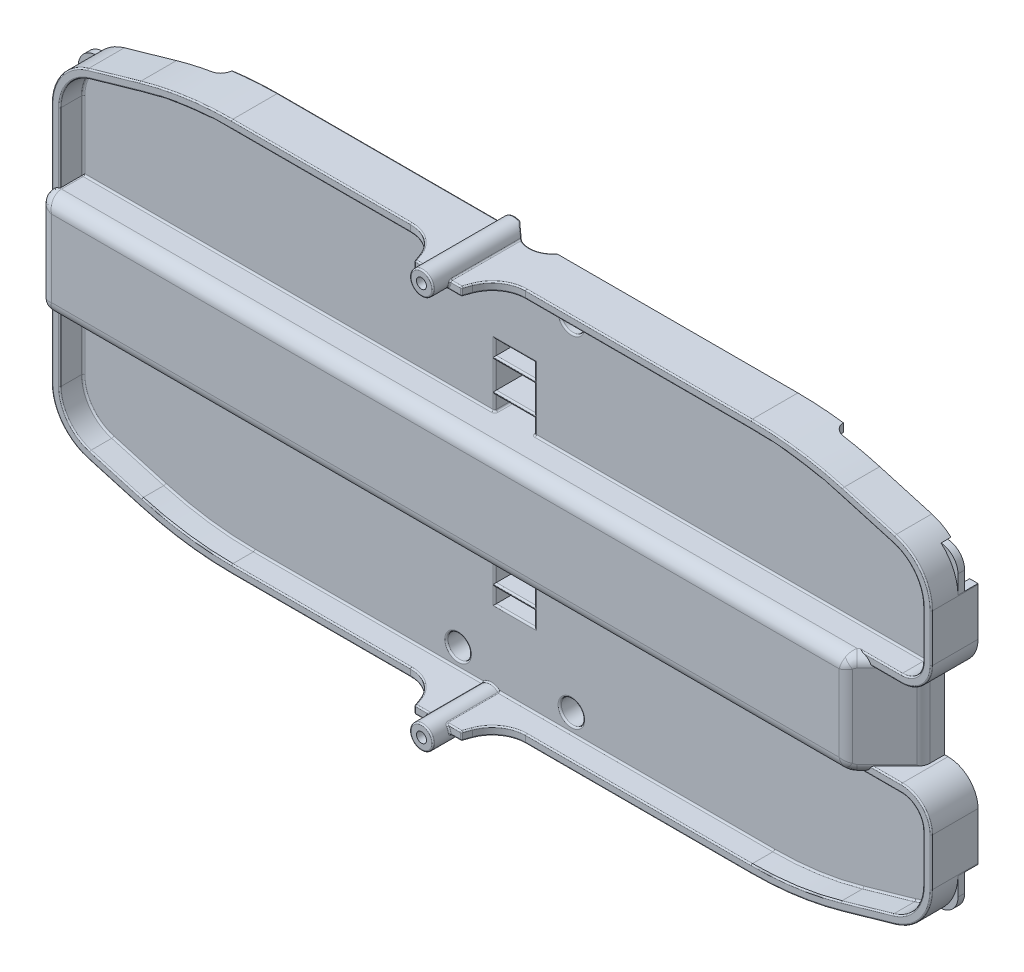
SolidWorks part; units mm, degrees
ref_plane "Face" through (0, 0, 0) normal (0, 0, 1) x (1, 0, 0)
ref_plane "Dessus" through (0, 0, 0) normal (0, 1, 0) x (1, 0, 0)
ref_plane "Droite" through (0, 0, 0) normal (1, 0, 0) x (0, 0, -1)
sketch "Esquisse1" plane through (0, 0, 0) normal (0, 0, 1) x (1, 0, 0)
  line L0 (-152.067, 0) -> (168.0741, 0) construction
  line L1 (0, 92.3334) -> (0, -84.9155) construction
  line L2 (-77.9459, 59) -> (77.9459, 59)
  line L3 (132, 36.2269) -> (132, 22)
  line L4 (105.5097, 55.1262) -> (121.1346, 50.6458)
  line L6 (-132, 13) -> (123, 13)
  line L12 (-105.5097, 55.1262) -> (-121.1346, 50.6458)
  line L13 (-132, 36.2269) -> (-132, 13)
  arc A0 (132, 36.2269) -> (121.1346, 50.6458) centre (117, 36.2269) ccw
  arc A1 (123, 13) -> (132, 22) centre (123, 22) ccw
  arc A7 (-132, 36.2269) -> (-121.1346, 50.6458) centre (-117, 36.2269) cw
  arc A8 (77.9459, 59) -> (105.5097, 55.1262) centre (77.9459, -41) cw
  arc A9 (-105.5097, 55.1262) -> (-77.9459, 59) centre (-77.9459, -41) cw
  point P37 (0, 59)
  point P38 (92, 59)
  point P41 (-92, 59)
  dimension "D3" = 15
  dimension "D6" = 9
  dimension "D7" = 26
  dimension "D10" = 100
  dimension "D2" = 59
  dimension "D4" = 16
  dimension "D5" = 40
  dimension "D8" = 264
extrude "Extrusion3" add sketch "Esquisse1" along normal mid plane 14
sketch "Esquisse6" plane through (0, 0, 7) normal (0, 0, 1) x (1, 0, 0)
  line L12 (77.9459, 56.5) -> (-77.9459, 56.5)
  line L13 (-104.8206, 52.723) -> (-120.4455, 48.2426)
  line L14 (-129.5, 36.2269) -> (-129.5, 15.5)
  line L15 (-129.5, 15.5) -> (123, 15.5)
  line L16 (129.5, 22) -> (129.5, 36.2269)
  line L17 (120.4455, 48.2426) -> (104.8206, 52.723)
  line L18 (77.9459, 56.5) -> (-77.9459, 56.5)
  line L19 (-104.8206, 52.723) -> (-120.4455, 48.2426)
  line L20 (-129.5, 36.2269) -> (-129.5, 15.5)
  line L21 (-129.5, 15.5) -> (123, 15.5)
  line L22 (129.5, 22) -> (129.5, 36.2269)
  line L23 (120.4455, 48.2426) -> (104.8206, 52.723)
  arc A10 (104.8206, 52.723) -> (77.9459, 56.5) centre (77.9459, -41) ccw
  arc A11 (-77.9459, 56.5) -> (-104.8206, 52.723) centre (-77.9459, -41) ccw
  arc A12 (-120.4455, 48.2426) -> (-129.5, 36.2269) centre (-117, 36.2269) ccw
  arc A13 (123, 15.5) -> (129.5, 22) centre (123, 22) ccw
  arc A14 (129.5, 36.2269) -> (120.4455, 48.2426) centre (117, 36.2269) ccw
  arc A15 (104.8206, 52.723) -> (77.9459, 56.5) centre (77.9459, -41) ccw
  arc A16 (-77.9459, 56.5) -> (-104.8206, 52.723) centre (-77.9459, -41) ccw
  arc A17 (-120.4455, 48.2426) -> (-129.5, 36.2269) centre (-117, 36.2269) ccw
  arc A18 (123, 15.5) -> (129.5, 22) centre (123, 22) ccw
  arc A19 (129.5, 36.2269) -> (120.4455, 48.2426) centre (117, 36.2269) ccw
  dimension "D1" = 2.5
extrude "Enlèv. mat.-Extru.2" cut sketch "Esquisse6" against normal blind 7
sketch "Esquisse8" plane through (0, 15.5, 0) normal (0, 1, 0) x (-1, 0, 0)
  line L0 (-122, -7) -> (-122, -1)
  line L1 (-105.5097, -7) -> (-77.9459, -7) construction
  line L2 (-122, -1) -> (-110, 11)
  line L3 (-110, 11) -> (132, 11)
  line L4 (132, -7) -> (132, 11)
  line L5 (-132, 7) -> (-132, -7) construction
  line L6 (77.9459, -7) -> (105.5097, -7) construction
  line L7 (-119, -7) -> (-119, -2.2426)
  line L8 (-119, -2.2426) -> (-108.7574, 8)
  line L9 (-108.7574, 8) -> (129, 8)
  line L10 (129, -7) -> (129, 8)
  line L11 (-122, -7) -> (-119, -7)
  line L12 (129, -7) -> (132, -7)
  dimension "D1" = 10
  dimension "D2" = 18
  dimension "D3" = 45
  dimension "D4" = 12
  dimension "D5" = 3
extrude "Extrusion5" add sketch "Esquisse8" against normal blind 17
mirror "Symétrie3" about plane through (0, 0, 0) normal (0, 1, 0)
mirror "Symétrie4" about plane through (0, 0, 0) normal (0, 1, 0)
mirror "Symétrie5" about plane through (0, 0, 0) normal (0, 1, 0)
sketch "Esquisse9" plane through (0, -15.5, 0) normal (0, -1, 0) x (1, 0, 0)
  line L12 (109.7574, 7) -> (108.7574, 8) construction
  line L13 (-129, 7) -> (109.7574, 7) construction
  line L14 (-129, 8) -> (-129, 7) construction
  line L15 (108.7574, 8) -> (-129, 8) construction
  line L16 (109.7574, 7) -> (108.7574, 8)
  line L17 (-129, 7) -> (109.7574, 7)
  line L18 (-129, 8) -> (-129, 7)
  line L19 (108.7574, 8) -> (-129, 8)
extrude "Extrusion6" add sketch "Esquisse9" against normal blind 3
mirror "Symétrie6" about plane through (0, 0, 0) normal (0, 1, 0)
sketch "Esquisse10" plane through (0, 0, -7) normal (0, 0, -1) x (-1, 0, 0)
  line L0 (129.497, 36.5) -> (129.5, 36.5)
  line L1 (0, 0) -> (164.5571, 0) construction
  line L2 (129.497, -36.5) -> (129.5, -36.5)
  line L24 (129.5, -36.2269) -> (129.5, 36.2269)
  line L25 (120.4455, 48.2426) -> (104.8206, 52.723)
  line L26 (77.9459, 56.5) -> (-77.9459, 56.5)
  line L27 (-104.8206, 52.723) -> (-120.4455, 48.2426)
  line L28 (-129.5, 36.2269) -> (-129.5, 22)
  line L29 (-123, 15.5) -> (-119.5, 15.5)
  line L30 (-123, 15.5) -> (-119.5, 15.5)
  line L31 (-119.5, 15.5) -> (-119.5, -15.5)
  line L32 (-119.5, 15.5) -> (-119.5, -15.5)
  line L33 (-119.5, -15.5) -> (-123, -15.5)
  line L34 (-119.5, -15.5) -> (-123, -15.5)
  line L35 (-129.5, -22) -> (-129.5, -36.2269)
  line L36 (129.5, -36.5) -> (129.5, 36.5)
  line L37 (120.4455, 48.2426) -> (104.8206, 52.723)
  line L38 (77.9459, 56.5) -> (-77.9459, 56.5)
  line L39 (-104.8206, 52.723) -> (-120.4455, 48.2426)
  line L40 (-129.5, 36.2269) -> (-129.5, 22)
  line L41 (-129.5, -22) -> (-129.5, -36.2269)
  line L42 (-120.4455, -48.2426) -> (-104.8206, -52.723)
  line L43 (-120.4455, -48.2426) -> (-104.8206, -52.723)
  line L44 (-77.9459, -56.5) -> (77.9459, -56.5)
  line L45 (-77.9459, -56.5) -> (77.9459, -56.5)
  line L46 (104.8206, -52.723) -> (120.4455, -48.2426)
  line L47 (104.8206, -52.723) -> (120.4455, -48.2426)
  arc A0 (129.497, -36.5) -> (120.4455, -48.2426) centre (117, -36.2269) cw
  arc A20 (120.4455, -48.2426) -> (129.5, -36.2269) centre (117, -36.2269) ccw
  arc A21 (129.5, 36.2269) -> (120.4455, 48.2426) centre (117, 36.2269) ccw
  arc A22 (104.8206, 52.723) -> (77.9459, 56.5) centre (77.9459, -41) ccw
  arc A23 (-77.9459, 56.5) -> (-104.8206, 52.723) centre (-77.9459, -41) ccw
  arc A24 (-120.4455, 48.2426) -> (-129.5, 36.2269) centre (-117, 36.2269) ccw
  arc A25 (-129.5, 22) -> (-123, 15.5) centre (-123, 22) ccw
  arc A27 (-123, -15.5) -> (-129.5, -22) centre (-123, -22) ccw
  arc A28 (-123, -15.5) -> (-129.5, -22) centre (-123, -22) ccw
  arc A29 (-129.5, -36.2269) -> (-120.4455, -48.2426) centre (-117, -36.2269) ccw
  arc A30 (-129.5, -36.2269) -> (-120.4455, -48.2426) centre (-117, -36.2269) ccw
  arc A31 (129.497, 36.5) -> (120.4455, 48.2426) centre (117, 36.2269) ccw
  arc A32 (104.8206, 52.723) -> (77.9459, 56.5) centre (77.9459, -41) ccw
  arc A33 (-77.9459, 56.5) -> (-104.8206, 52.723) centre (-77.9459, -41) ccw
  arc A34 (-120.4455, 48.2426) -> (-129.5, 36.2269) centre (-117, 36.2269) ccw
  arc A35 (-129.5, 22) -> (-123, 15.5) centre (-123, 22) ccw
  arc A36 (-104.8206, -52.723) -> (-77.9459, -56.5) centre (-77.9459, 41) ccw
  arc A37 (-104.8206, -52.723) -> (-77.9459, -56.5) centre (-77.9459, 41) ccw
  arc A38 (77.9459, -56.5) -> (104.8206, -52.723) centre (77.9459, 41) ccw
  arc A39 (77.9459, -56.5) -> (104.8206, -52.723) centre (77.9459, 41) ccw
  point P10 (129.5, 0)
  dimension "D2" = 36.5
  dimension "D1" = 2.5
extrude "Enlèv. mat.-Extru.3" cut sketch "Esquisse10" against normal blind 4
fillet "Congé8" radius 2
fillet "Congé2" radius 3
fillet "Congé4" radius 4
sketch "Esquisse11" plane through (0, 0, -7) normal (0, 0, -1) x (-1, 0, 0)
  line L1 (91.6, 71.9843) -> (145.0851, 71.9843)
  line L2 (91.6, 71.9843) -> (91.6, 36.5)
  line L3 (91.6, 36.5) -> (145.0851, 36.5)
  line L4 (145.0851, 71.9843) -> (145.0851, 36.5)
  line L5 (0, 0) -> (241.3873, 0) construction
  line L6 (0, 0) -> (0, 112.0725) construction
  line L7 (-145.0851, 71.9843) -> (-145.0851, 36.5)
  line L8 (-91.6, 36.5) -> (-145.0851, 36.5)
  line L9 (-91.6, 71.9843) -> (-91.6, 36.5)
  line L10 (-91.6, 71.9843) -> (-145.0851, 71.9843)
  line L11 (-91.6, -71.9843) -> (-145.0851, -71.9843)
  line L12 (-91.6, -71.9843) -> (-91.6, -36.5)
  line L13 (-91.6, -36.5) -> (-145.0851, -36.5)
  line L14 (-145.0851, -71.9843) -> (-145.0851, -36.5)
  line L15 (145.0851, -71.9843) -> (145.0851, -36.5)
  line L16 (91.6, -36.5) -> (145.0851, -36.5)
  line L17 (91.6, -71.9843) -> (91.6, -36.5)
  line L18 (91.6, -71.9843) -> (145.0851, -71.9843)
  dimension "D2" = 36.5
extrude "Enlèv. mat.-Extru.4" cut sketch "Esquisse11" against normal blind 3
fillet "Congé6" radius 3
sketch "Esquisse12" plane through (0, 0, -3) normal (0, 0, -1) x (-1, 0, 0)
  line L0 (-119, -13) -> (129, -13) construction
  line L1 (-119, -13) -> (129, -13)
  line L2 (-119, -14) -> (129, -14)
  line L3 (-119, -13) -> (-119, -14)
  line L4 (129, -13) -> (129, -14)
  line L7 (0, 0) -> (-159.2405, 0) construction
  line L8 (129, 13) -> (129, 14)
  line L9 (-119, 13) -> (-119, 14)
  line L10 (-119, 14) -> (129, 14)
  line L11 (-119, 13) -> (129, 13)
  dimension "D1" = 1
extrude "Extrusion8" add sketch "Esquisse12" along normal blind 2
mirror "Symétrie7" about plane through (0, 0, 0) normal (0, 1, 0)
sketch "Esquisse14" plane through (0, 0, -3) normal (0, 0, -1) x (-1, 0, 0)
  line L0 (-119, -14) -> (129, -14) construction
  line L1 (-52.5, -14) -> (-51.5, -14)
  line L2 (-77.9459, -56.5) -> (77.9459, -56.5) construction
  line L3 (-52.5, -56.5) -> (-51.5, -56.5)
  line L4 (-52.5, -14) -> (-52.5, -56.5)
  line L5 (-51.5, -14) -> (-51.5, -56.5)
  line L6 (-129.5, -22) -> (-129.5, -36.2269) construction
  line L7 (0, 0) -> (189.4484, 0) construction
  line L8 (-17.5, -14) -> (-16.5, -14)
  line L9 (-17.5, -14) -> (-17.5, -56.5)
  line L10 (-17.5, -56.5) -> (-16.5, -56.5)
  line L11 (-16.5, -14) -> (-16.5, -56.5)
  line L12 (-16.5, 14) -> (-16.5, 56.5)
  line L13 (-17.5, 56.5) -> (-16.5, 56.5)
  line L14 (-17.5, 14) -> (-17.5, 56.5)
  line L15 (-17.5, 14) -> (-16.5, 14)
  line L16 (-51.5, 14) -> (-51.5, 56.5)
  line L17 (-52.5, 14) -> (-52.5, 56.5)
  line L18 (-52.5, 56.5) -> (-51.5, 56.5)
  line L19 (-52.5, 14) -> (-51.5, 14)
  line L20 (0, 0) -> (0, 94.726) construction
  line L21 (52.5, 14) -> (51.5, 14)
  line L22 (52.5, 56.5) -> (51.5, 56.5)
  line L23 (52.5, 14) -> (52.5, 56.5)
  line L24 (51.5, 14) -> (51.5, 56.5)
  line L25 (17.5, 14) -> (16.5, 14)
  line L26 (17.5, 14) -> (17.5, 56.5)
  line L27 (17.5, 56.5) -> (16.5, 56.5)
  line L28 (16.5, 14) -> (16.5, 56.5)
  line L29 (16.5, -14) -> (16.5, -56.5)
  line L30 (17.5, -56.5) -> (16.5, -56.5)
  line L31 (17.5, -14) -> (17.5, -56.5)
  line L32 (17.5, -14) -> (16.5, -14)
  line L33 (51.5, -14) -> (51.5, -56.5)
  line L34 (52.5, -14) -> (52.5, -56.5)
  line L35 (52.5, -56.5) -> (51.5, -56.5)
  line L36 (52.5, -14) -> (51.5, -14)
  line L37 (77.9459, 56.5) -> (-77.9459, 56.5) construction
  dimension "D1" = 1
  dimension "D2" = 77
  dimension "D3" = 1
  dimension "D4" = 34
extrude "Extrusion9" add sketch "Esquisse14" along normal blind 4
sketch "Esquisse15" plane through (0, 0, -3) normal (0, 0, -1) x (-1, 0, 0)
  line L0 (129.5, -36.5) -> (129.5, 36.5) construction
  line L1 (129.5, 35.5) -> (52.5, 35.5)
  line L2 (129.5, 35.5) -> (129.5, 36.5)
  line L3 (129.5, 36.5) -> (52.5, 36.5)
  line L4 (52.5, 35.5) -> (52.5, 36.5)
  line L5 (124.3571, 47.5) -> (52.5, 47.5)
  line L6 (124.3571, 47.5) -> (124.3571, 48.5)
  line L7 (124.3571, 48.5) -> (52.5, 48.5)
  line L8 (52.5, 47.5) -> (52.5, 48.5)
  line L9 (52.5, 14) -> (52.5, 56.5) construction
  line L11 (0, 0) -> (165.7762, 0) construction
  line L12 (0, 0) -> (0, 78.154) construction
  line L13 (-52.5, 47.5) -> (-52.5, 48.5)
  line L14 (-124.3571, 48.5) -> (-52.5, 48.5)
  line L15 (-124.3571, 47.5) -> (-124.3571, 48.5)
  line L16 (-124.3571, 47.5) -> (-52.5, 47.5)
  line L17 (-52.5, 35.5) -> (-52.5, 36.5)
  line L18 (-129.5, 36.5) -> (-52.5, 36.5)
  line L19 (-129.5, 35.5) -> (-129.5, 36.5)
  line L20 (-129.5, 35.5) -> (-52.5, 35.5)
  line L21 (-129.5, -35.5) -> (-52.5, -35.5)
  line L22 (-129.5, -35.5) -> (-129.5, -36.5)
  line L23 (-129.5, -36.5) -> (-52.5, -36.5)
  line L24 (-52.5, -35.5) -> (-52.5, -36.5)
  line L25 (-124.3571, -47.5) -> (-52.5, -47.5)
  line L26 (-124.3571, -47.5) -> (-124.3571, -48.5)
  line L27 (-124.3571, -48.5) -> (-52.5, -48.5)
  line L28 (-52.5, -47.5) -> (-52.5, -48.5)
  line L29 (52.5, -47.5) -> (52.5, -48.5)
  line L30 (124.3571, -48.5) -> (52.5, -48.5)
  line L31 (124.3571, -47.5) -> (124.3571, -48.5)
  line L32 (124.3571, -47.5) -> (52.5, -47.5)
  line L33 (52.5, -35.5) -> (52.5, -36.5)
  line L34 (129.5, -36.5) -> (52.5, -36.5)
  line L35 (129.5, -35.5) -> (129.5, -36.5)
  line L36 (129.5, -35.5) -> (52.5, -35.5)
  dimension "D1" = 1
  dimension "D2" = 1
  dimension "D3" = 48.5
  dimension "D4" = 13
extrude "Extrusion10" add sketch "Esquisse15" along normal blind 1
fillet "Congé10" radius 0.4
sketch "Esquisse16" plane through (0, 0, -7) normal (0, 0, -1) x (-1, 0, 0)
  line L0 (17.5, 14) -> (17.5, 56.5) construction
  line L1 (16.5, 56.5) -> (16.5, 14) construction
  line L2 (-16.5, 14) -> (-16.5, 56.5) construction
  line L3 (-17.5, 56.5) -> (-17.5, 14) construction
  line L4 (-51.5, 14) -> (-51.5, 56.5) construction
  line L5 (-52.5, 56.5) -> (-52.5, 14) construction
  line L6 (17.5, -56.1477) -> (17.5, 56.5)
  line L7 (16.5, 56.5) -> (16.5, -56.1477)
  line L8 (-16.5, -56.1477) -> (-16.5, 56.5)
  line L9 (-17.5, 56.5) -> (-17.5, -56.1477)
  line L10 (-51.5, -56.1477) -> (-51.5, 56.5)
  line L11 (-52.5, 56.5) -> (-52.5, -56.1477)
  line L12 (-52.5, 56.5) -> (-51.5, 56.5)
  line L14 (-51.5, -56.5) -> (-17.5, -56.5) construction
  line L15 (-52.5, -56.1477) -> (-51.5, -56.1477)
  line L18 (16.5, -56.1477) -> (17.5, -56.1477)
  line L19 (-17.5, -56.1477) -> (-16.5, -56.1477)
  line L20 (-17.5, 56.5) -> (-16.5, 56.5)
  line L21 (16.5, 56.5) -> (17.5, 56.5)
  line L22 (52.5, 14) -> (52.5, 56.5) construction
  line L23 (51.5, 56.5) -> (51.5, 14) construction
  line L24 (52.5, -56.5) -> (52.5, 56.5)
  line L25 (51.5, 56.5) -> (51.5, -56.5)
  line L26 (51.5, -56.5) -> (52.5, -56.5)
  line L29 (51.5, 56.5) -> (52.5, 56.5)
extrude "Extrusion11" add sketch "Esquisse16" against normal up to body separate body
sketch "Esquisse17" plane through (0, 0, -3) normal (0, 0, -1) x (-1, 0, 0)
  line L0 (0, 0) -> (0, 78.5356) construction
  line L2 (10, 13) -> (-10, 13)
  line L3 (-16.5, 13) -> (16.5, 13) construction
  line L4 (-10, 13) -> (-10, 16)
  line L5 (-10, 16) -> (-9.5, 16)
  line L6 (-7.5, 18) -> (-7.5, 35)
  line L7 (-7.5, 35) -> (7.5, 35)
  line L8 (7.5, 18) -> (7.5, 35)
  line L9 (10, 16) -> (9.5, 16)
  line L10 (10, 13) -> (10, 16)
  line L11 (0, 0) -> (63.3273, 0) construction
  line L12 (10, -13) -> (10, -16)
  line L13 (10, -16) -> (9.5, -16)
  line L14 (7.5, -18) -> (7.5, -35)
  line L15 (-7.5, -35) -> (7.5, -35)
  line L16 (-7.5, -18) -> (-7.5, -35)
  line L17 (-10, -16) -> (-9.5, -16)
  line L18 (-10, -13) -> (-10, -16)
  line L19 (10, -13) -> (-10, -13)
  arc A0 (-7.5, 18) -> (-9.5, 16) centre (-9.5, 18) cw
  arc A1 (7.5, 18) -> (9.5, 16) centre (9.5, 18) ccw
  arc A2 (7.5, -18) -> (9.5, -16) centre (9.5, -18) cw
  arc A3 (-7.5, -18) -> (-9.5, -16) centre (-9.5, -18) ccw
  point P17 (0, 35)
  point P19 (0, 13)
  point P32 (0, -13)
  point P33 (0, -35)
  dimension "D5" = 2
  dimension "D1" = 10
  dimension "D2" = 3
  dimension "D3" = 22
  dimension "D4" = 15
extrude "Extrusion12" add sketch "Esquisse17" along normal blind 10
sketch "Esquisse18" plane through (0, 0, -13) normal (0, 0, -1) x (-1, 0, 0)
  line L0 (0, 0) -> (0, 66.6064) construction
  line L1 (-10, 13) -> (10, 13) construction
  line L2 (-3.5, 35) -> (-2.5, 35)
  line L3 (-3.5, 35) -> (-3.5, 13)
  line L4 (-3.5, 13) -> (-2.5, 13)
  line L5 (-2.5, 35) -> (-2.5, 13)
  line L6 (7.5, 35) -> (-7.5, 35) construction
  line L7 (2.5, 35) -> (2.5, 13)
  line L8 (3.5, 13) -> (2.5, 13)
  line L9 (3.5, 35) -> (3.5, 13)
  line L10 (3.5, 35) -> (2.5, 35)
  line L11 (0, 0) -> (40.6148, 0) construction
  line L12 (3.5, -35) -> (2.5, -35)
  line L13 (3.5, -35) -> (3.5, -13)
  line L14 (3.5, -13) -> (2.5, -13)
  line L15 (2.5, -35) -> (2.5, -13)
  line L16 (-2.5, -35) -> (-2.5, -13)
  line L17 (-3.5, -13) -> (-2.5, -13)
  line L18 (-3.5, -35) -> (-3.5, -13)
  line L19 (-3.5, -35) -> (-2.5, -35)
  dimension "D1" = 5
  dimension "D2" = 1
extrude "Extrusion13" add sketch "Esquisse18" along normal blind 2
chamfer "Chanfrein2" distance 2 angle 45
sketch "Esquisse19" plane through (0, 0, -13) normal (0, 0, -1) x (-1, 0, 0)
  line L4 (2.5, 13) -> (2.5, 35)
  line L5 (2.5, 35) -> (-2.5, 35)
  line L6 (-2.5, 35) -> (-2.5, 13)
  line L7 (-2.5, 13) -> (2.5, 13)
  line L8 (2.5, 13) -> (2.5, 35)
  line L9 (2.5, 35) -> (-2.5, 35)
  line L10 (-2.5, 35) -> (-2.5, 13)
  line L11 (-2.5, 13) -> (2.5, 13)
  line L12 (-2.5, -13) -> (-2.5, -35)
  line L13 (-2.5, -35) -> (2.5, -35)
  line L14 (2.5, -35) -> (2.5, -13)
  line L15 (2.5, -13) -> (-2.5, -13)
  line L16 (-2.5, -13) -> (-2.5, -35)
  line L17 (-2.5, -35) -> (2.5, -35)
  line L18 (2.5, -35) -> (2.5, -13)
  line L19 (2.5, -13) -> (-2.5, -13)
  dimension "D1" = 0
  dimension "D2" = 0
extrude "Enlèv. mat.-Extru.5" cut sketch "Esquisse19" against normal blind 4
fillet "Congé11" radius 2.5
sketch "Esquisse20" plane through (0, 0, -13) normal (0, 0, -1) x (-1, 0, 0)
  line L0 (-10, 13) -> (-5.5, 13) construction
  line L1 (-7.75, 13) -> (7.052, 13)
  line L2 (-7.75, 13) -> (-7.75, 14.5)
  line L3 (-7.75, 14.5) -> (7.052, 14.5)
  line L4 (7.052, 13) -> (7.052, 14.5)
  line L5 (0, 0) -> (91.6094, 0) construction
  line L6 (7.052, -13) -> (7.052, -14.5)
  line L7 (-7.75, -14.5) -> (7.052, -14.5)
  line L8 (-7.75, -13) -> (-7.75, -14.5)
  line L9 (-7.75, -13) -> (7.052, -13)
  dimension "D1" = 1.5
extrude "Extrusion14" add sketch "Esquisse20" against normal up to body separate body
ref_plane "Plan1" through (0, 21, 0) normal (0, -1, 0) x (1, 0, 0)
sketch "Esquisse21" plane through (0, 21, 0) normal (0, -1, 0) x (1, 0, 0)
  line L0 (-16.5, -3) -> (-10, -3) construction
  line L1 (-12, -3) -> (12, -3)
  line L2 (0, 0) -> (0, -20.8343) construction
  line L3 (-12, -3) -> (-10.2314, -16.2643)
  line L4 (-8.249, -18) -> (8.249, -18)
  line L5 (12, -3) -> (10.2314, -16.2643)
  arc A0 (-8.249, -18) -> (-10.2314, -16.2643) centre (-8.249, -16) cw
  arc A1 (10.2314, -16.2643) -> (8.249, -18) centre (8.249, -16) cw
  point P10 (0, -18)
  point P11 (0, -3)
  point P13 (-10, -18)
  point P16 (10, -18)
  dimension "D4" = 2
  dimension "D1" = 12
  dimension "D2" = 10
  dimension "D3" = 15
extrude "Extrusion15" add sketch "Esquisse21" against normal blind 2
ref_plane "Plan2" through (0, 27, 0) normal (0, -1, 0) x (1, 0, 0)
sketch "Esquisse22" plane through (0, 27, 0) normal (0, -1, 0) x (1, 0, 0)
  line L0 (0, 0) -> (0, -28.0469) construction
  line L1 (-14.1283, -3) -> (-12.0714, -16.3056)
  line L2 (16.5, -3) -> (-16.5, -3) construction
  line L3 (-10.0949, -18) -> (0, -18)
  line L4 (-14.1283, -3) -> (0, -3)
  line L5 (-8.249, -18) -> (8.249, -18) construction
  line L6 (0, -18) -> (8.944, -18)
  line L7 (10.9213, -16.3003) -> (12.9413, -3)
  line L8 (12.9413, -3) -> (0, -3)
  arc A0 (-12.0714, -16.3056) -> (-10.0949, -18) centre (-10.0949, -16) ccw
  arc A1 (8.944, -18) -> (10.9213, -16.3003) centre (8.944, -16) ccw
  dimension "D1" = 2
  dimension "D2" = 2
extrude "Extrusion16" add sketch "Esquisse22" against normal blind 2
sketch "Esquisse23" plane through (0, 23, 0) normal (0, 1, 0) x (-1, 0, 0)
  circle A0 centre (0, -11.5) radius 6
  arc A1 (2.5, -11.5) -> (0, -9) centre (0, -11.5) ccw construction
  dimension "D1" = 12
extrude "Extrusion17" add sketch "Esquisse23" along normal blind 4
mirror "Symétrie10" about plane through (0, 0, 0) normal (0, 1, 0)
sketch "Esquisse25" plane through (0, 0, 0) normal (0, 0, 1) x (1, 0, 0)
  line L0 (0, 0) -> (0, 48.6052) construction
  line L1 (0, 0) -> (136.0911, 0) construction
  line L2 (-6, 29) -> (-6, 21)
  line L3 (-6, 21) -> (6, 21)
  line L4 (-6, 29) -> (6, 29)
  line L5 (12.9413, 29) -> (7.5, 29) construction
  line L6 (-6, 25) -> (11.3284, 25) construction
  line L7 (12, 21) -> (7.5, 21) construction
  line L8 (6, 29) -> (6, 21)
  line L9 (6, -29) -> (6, -21)
  line L10 (-6, -29) -> (6, -29)
  line L11 (-6, -21) -> (6, -21)
  line L12 (-6, -29) -> (-6, -21)
  line L13 (6, 20) -> (-6, 20)
  line L14 (-6, 20) -> (-6, 15.5)
  line L15 (-6, 15.5) -> (6, 15.5)
  line L16 (-129, 15.5) -> (109.7574, 15.5) construction
  line L17 (6, 20) -> (6, 15.5)
  line L18 (6, -20) -> (6, -15.5)
  line L19 (-6, -15.5) -> (6, -15.5)
  line L20 (-6, -20) -> (-6, -15.5)
  line L21 (6, -20) -> (-6, -20)
  line L22 (6, 30) -> (6, 34.5)
  line L23 (-6, 34.5) -> (6, 34.5)
  line L24 (-6, 30) -> (-6, 34.5)
  line L25 (6, 30) -> (-6, 30)
  line L26 (-6, -25) -> (11.3284, -25) construction
  line L27 (6, -30) -> (-6, -30)
  line L28 (-6, -30) -> (-6, -34.5)
  line L29 (-6, -34.5) -> (6, -34.5)
  line L30 (6, -30) -> (6, -34.5)
  point P14 (0, 29)
  point P15 (0, 21)
  point P19 (0, -21)
  point P20 (0, -29)
  point P28 (0, 15.5)
  point P29 (0, 20)
  point P33 (0, -20)
  point P34 (0, -15.5)
  point P40 (0, 30)
  point P41 (0, 34.5)
  point P48 (0, -34.5)
  point P49 (0, -30)
  dimension "D1" = 12
  dimension "D2" = 1
extrude "Enlèv. mat.-Extru.6" cut sketch "Esquisse25" against normal blind 10
sketch "Esquisse26" plane through (0, 29, 0) normal (0, 1, 0) x (-1, 0, 0)
  circle A0 centre (0, -11.5) radius 2.5
extrude "Enlèv. mat.-Extru.7" cut sketch "Esquisse26" against normal blind 10
sketch "Esquisse27" plane through (0, 20, 0) normal (0, -1, 0) x (1, 0, 0)
  line L0 (2, -10) -> (3.1623, -10)
  line L1 (-2, -10) -> (-3.1623, -10)
  line L2 (6, -10) -> (2, -10) construction
  line L3 (-2, -10) -> (-6, -10) construction
  arc A0 (2, -10) -> (-2, -10) centre (0, -11.5) ccw construction
  arc A1 (2, -10) -> (-2, -10) centre (0, -11.5) ccw
  arc A2 (3.1623, -10) -> (-3.1623, -10) centre (0, -11.5) ccw
  dimension "D1" = 1
extrude "Extrusion20" add sketch "Esquisse27" along normal blind 5
mirror "Symétrie11" about plane through (0, 0, 0) normal (0, 1, 0)
sketch "Esquisse28" plane through (0, -30, 0) normal (0, -1, 0) x (1, 0, 0)
  line L0 (-3.1623, -10) -> (-2, -10)
  line L1 (2, -10) -> (3.1623, -10)
  arc A0 (2, -10) -> (-2, -10) centre (0, -11.5) ccw
  arc A1 (3.1623, -10) -> (-3.1623, -10) centre (0, -11.5) ccw construction
  arc A2 (3.1623, -10) -> (-3.1623, -10) centre (0, -11.5) ccw
extrude "Extrusion21" add sketch "Esquisse28" along normal blind 5
mirror "Symétrie12" about plane through (0, 0, 0) normal (0, 1, 0)
fillet "Congé12" radius 0.2
fillet "Congé13" radius 0.2
sketch "Esquisse29" plane through (0, 0, -3) normal (0, 0, -1) x (-1, 0, 0)
  line L0 (0, 0) -> (0, 77.2503) construction
  line L1 (0, 0) -> (162.731, 0) construction
  circle A0 centre (-17, 51) radius 4.75
  circle A1 centre (17, 51) radius 4.75
  circle A2 centre (-17, -51) radius 4.75
  circle A3 centre (17, -51) radius 4.75
  dimension "D2" = 9.5
  dimension "D1" = 17
  dimension "D3" = 51
extrude "Extrusion22" add sketch "Esquisse29" along normal blind 5
sketch "Esquisse30" plane through (0, 0, 0) normal (0, 0, 1) x (1, 0, 0)
  line L0 (0, 0) -> (0, 76.7727) construction
  line L1 (0, 0) -> (34.8838, 0) construction
  circle A0 centre (17, 51) radius 3.5
  circle A1 centre (-17, 51) radius 3.5
  circle A2 centre (-17, -51) radius 3.5
  circle A3 centre (17, -51) radius 3.5
  dimension "D1" = 7
extrude "Enlèv. mat.-Extru.8" cut sketch "Esquisse30" against normal blind 7
fillet "Congé15" radius 0.5
sketch "Esquisse31" plane through (0, 0, -7) normal (0, 0, 1) x (1, 0, 0)
  line L0 (0, 0) -> (0, 71.1481) construction
  line L1 (0, 0) -> (38.9814, 0) construction
  circle A0 centre (17, 51) radius 1.5
  circle A1 centre (-17, 51) radius 1.5
  circle A2 centre (-17, -51) radius 1.5
  circle A3 centre (17, -51) radius 1.5
  dimension "D1" = 3
extrude "Enlèv. mat.-Extru.9" cut sketch "Esquisse31" against normal blind 7
sketch "Esquisse33" plane through (0, 59, 0) normal (0, 1, 0) x (-1, 0, 0)
  circle A0 centre (0, -11.5) radius 7
  dimension "D1" = 14
sketch "Esquisse34" plane through (0, 0, -7) normal (0, 0, -1) x (-1, 0, 0)
  circle A0 centre (7, 59) radius 3.5
  dimension "D1" = 7
  dimension "D2" = 59
  dimension "D3" = 7
extrude "Extrusion23" add sketch "Esquisse34" against normal blind 28
sketch "Esquisse35" plane through (0, 59, 0) normal (0, 1, 0) x (-1, 0, 0)
  line L0 (7, 21) -> (7, -24.3314) construction
  line L1 (10.5, 21) -> (3.5, 21) construction
  line L2 (0, 16) -> (-3.3934, 6.6)
  line L3 (3.5, 6.6) -> (-77.9459, 6.6) construction
  line L4 (14, 16) -> (17.3934, 6.6)
  line L5 (0, 16) -> (14, 16)
  line L6 (-3.3934, 6.6) -> (17.3934, 6.6)
  point P11 (7, 16)
  point P12 (7, 6.6)
  dimension "D1" = 5
extrude "Extrusion24" add sketch "Esquisse35" against normal blind 2.5
mirror "Symétrie13" about plane through (0, 0, 0) normal (0, 1, 0)
extrude "Enlèv. mat.-Extru.10" cut sketch "Esquisse33" against normal mid plane 12.5
mirror "Symétrie14" about plane through (0, 0, 0) normal (0, 1, 0)
fillet "Congé16" radius 10
fillet "Congé17" radius 0.4
fillet "Congé18" radius 0.4
fillet "Congé19" radius 0.4
sketch "Esquisse36" plane through (0, 0, 21) normal (0, 0, 1) x (1, 0, 0)
  line L0 (0, 0) -> (43.8034, 0) construction
  circle A0 centre (-7, 59) radius 1.5
  circle A1 centre (-7, -59) radius 1.5
  dimension "D1" = 3
extrude "Enlèv. mat.-Extru.11" cut sketch "Esquisse36" against normal blind 10
mirror "Symétrie15" about plane through (0, 0, 0) normal (0, 1, 0)
fillet "Congé20" radius 0.2
sketch "Esquisse40" plane through (0, 0, -7) normal (0, 0, -1) x (-1, 0, 0)
  line L0 (131.9975, -36.5) -> (129.5, -36.5) construction
  line L1 (129.5, 36.5) -> (132, 36.5)
  line L2 (129.5, 36.5) -> (129.5, -36.5)
  line L3 (129.5, -36.5) -> (132, -36.5)
  line L4 (132, 36.5) -> (132, -36.5)
  line L5 (132, 36.2269) -> (132, -36.2269) construction
extrude "Extrusion25" add sketch "Esquisse40" against normal blind 5
sketch "Esquisse41" plane through (0, 0, -3) normal (0, 0, -1) x (-1, 0, 0)
  line L0 (52.5, 47.5) -> (122.4006, 47.5) construction
  line L1 (55.2535, 47.5) -> (141.2474, 47.5)
  line L2 (55.2535, 47.5) -> (55.2535, 36.5)
  line L3 (55.2535, 36.5) -> (141.2474, 36.5)
  line L4 (141.2474, 47.5) -> (141.2474, 36.5)
  line L5 (129.497, 36.5) -> (52.5, 36.5) construction
  line L6 (0, 0) -> (157.5978, 0) construction
  line L7 (141.2474, -47.5) -> (141.2474, -36.5)
  line L8 (55.2535, -36.5) -> (141.2474, -36.5)
  line L9 (55.2535, -47.5) -> (55.2535, -36.5)
  line L10 (55.2535, -47.5) -> (141.2474, -47.5)
  line L11 (0, 0) -> (0, 85.161) construction
  line L12 (-55.2535, -47.5) -> (-141.2474, -47.5)
  line L13 (-55.2535, -47.5) -> (-55.2535, -36.5)
  line L14 (-55.2535, -36.5) -> (-141.2474, -36.5)
  line L15 (-141.2474, -47.5) -> (-141.2474, -36.5)
  line L16 (-141.2474, 47.5) -> (-141.2474, 36.5)
  line L17 (-55.2535, 36.5) -> (-141.2474, 36.5)
  line L18 (-55.2535, 47.5) -> (-55.2535, 36.5)
  line L19 (-55.2535, 47.5) -> (-141.2474, 47.5)
extrude "Enlèv. mat.-Extru.12" cut sketch "Esquisse41" along normal blind 3
sketch "Esquisse42" plane through (0, 0, -3) normal (0, 0, -1) x (-1, 0, 0)
  line L0 (52.5, 42) -> (136.3913, 42) construction
  line L1 (52.5, -56.5) -> (52.5, 56.5) construction
  line L2 (52.5, 47.5) -> (126.8953, 47.5) construction
  line L3 (132, 36.5) -> (132, 42)
  line L4 (126.5, 47.5) -> (116.046, 47.5)
  line L5 (116.046, 47.5) -> (116.046, 36.5)
  line L6 (129.5, 36.5) -> (52.5, 36.5) construction
  line L7 (116.046, 36.5) -> (132, 36.5)
  line L8 (0, 0) -> (160.3643, 0) construction
  line L9 (0, 0) -> (0, 72.9411) construction
  line L10 (116.046, -36.5) -> (132, -36.5)
  line L11 (116.046, -47.5) -> (116.046, -36.5)
  line L12 (126.5, -47.5) -> (116.046, -47.5)
  line L13 (132, -36.5) -> (132, -42)
  line L14 (-132, -36.5) -> (-132, -42)
  line L15 (-126.5, -47.5) -> (-116.046, -47.5)
  line L16 (-116.046, -47.5) -> (-116.046, -36.5)
  line L17 (-116.046, -36.5) -> (-132, -36.5)
  line L18 (-116.046, 36.5) -> (-132, 36.5)
  line L19 (-116.046, 47.5) -> (-116.046, 36.5)
  line L20 (-126.5, 47.5) -> (-116.046, 47.5)
  line L21 (-132, 36.5) -> (-132, 42)
  arc A0 (132, 42) -> (126.5, 47.5) centre (126.5, 42) ccw
  arc A1 (132, -42) -> (126.5, -47.5) centre (126.5, -42) cw
  arc A2 (-132, -42) -> (-126.5, -47.5) centre (-126.5, -42) ccw
  arc A3 (-132, 42) -> (-126.5, 47.5) centre (-126.5, 42) cw
  dimension "D2" = 11
  dimension "D1" = 5.5
extrude "Extrusion26" add sketch "Esquisse42" against normal blind 2
sketch "Esquisse43" plane through (0, 0, -3) normal (0, 0, -1) x (-1, 0, 0)
  line L0 (52.5, 42) -> (133.9024, 42) construction
  line L1 (52.5, -56.5) -> (52.5, 56.5) construction
  line L2 (52.5, 47.5) -> (126.8953, 47.5) construction
  line L3 (132, 36.5) -> (132, 42) construction
  line L4 (0, 0) -> (164.8593, 0) construction
  line L5 (0, 0) -> (0, 75.5498) construction
  circle A0 centre (74, 42) radius 2
  circle A1 centre (126, 42) radius 2
  circle A2 centre (126, -42) radius 2
  circle A3 centre (74, -42) radius 2
  circle A4 centre (-74, -42) radius 2
  circle A5 centre (-126, -42) radius 2
  circle A6 centre (-126, 42) radius 2
  circle A7 centre (-74, 42) radius 2
  dimension "D2" = 4
  dimension "D3" = 4
  dimension "D1" = 5.5
  dimension "D4" = 52
  dimension "D5" = 6
extrude "Extrusion27" add sketch "Esquisse43" along normal blind 1
